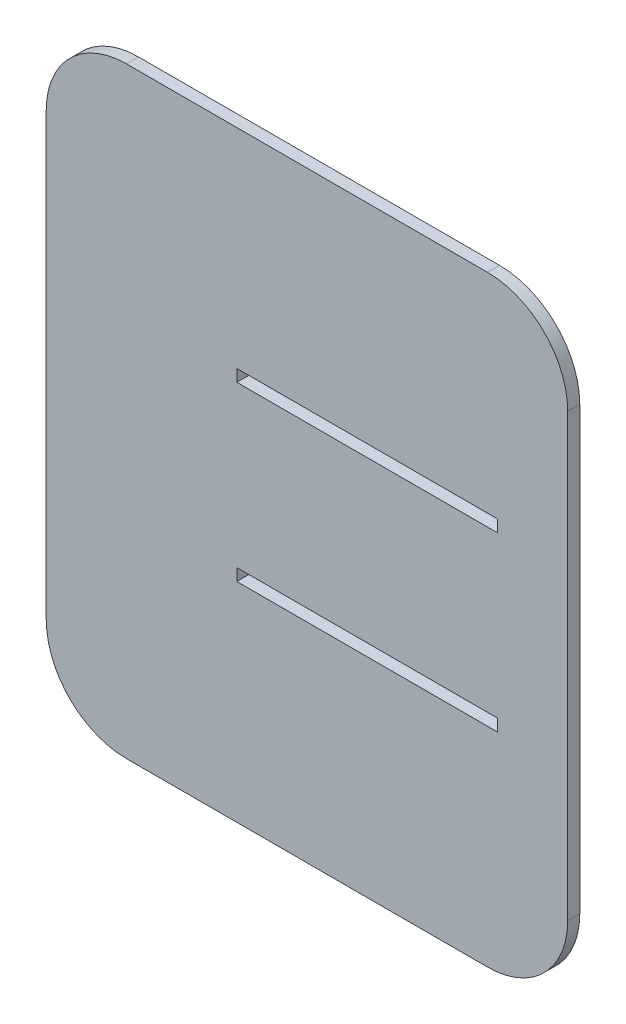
SolidWorks part; units mm, degrees
ref_plane "Plan de face" through (0, 0, 0) normal (0, 0, 1) x (1, 0, 0)
ref_plane "Plan de dessus" through (0, 0, 0) normal (0, 1, 0) x (1, 0, 0)
ref_plane "Plan de droite" through (0, 0, 0) normal (1, 0, 0) x (0, 0, -1)
sketch "Esquisse1" plane through (0, 0, 0) normal (0, 0, 1) x (1, 0, 0)
  line L0 (-13.7092, 13.9105) -> (115.8085, 13.9105) construction
  line L1 (-5.6409, 88.9105) -> (84.3591, 88.9105)
  line L3 (-5.6409, -61.0895) -> (84.3591, -61.0895)
  line L4 (104.3591, 68.9105) -> (104.3591, -41.0895)
  line L5 (86.8591, 33.9105) -> (86.8591, 36.9105)
  line L6 (21.8591, -6.0895) -> (86.8591, -6.0895)
  line L7 (21.8591, -6.0895) -> (21.8591, -9.0895)
  line L8 (21.8591, -9.0895) -> (86.8591, -9.0895)
  line L9 (86.8591, -6.0895) -> (86.8591, -9.0895)
  line L10 (21.8591, 33.9105) -> (21.8591, 36.9105)
  line L11 (21.8591, 36.9105) -> (86.8591, 36.9105)
  line L12 (21.8591, 33.9105) -> (86.8591, 33.9105)
  line L19 (-25.6409, 68.9105) -> (-25.6409, -41.0895)
  arc A4 (84.3591, -61.0895) -> (104.3591, -41.0895) centre (84.3591, -41.0895) ccw
  arc A5 (104.3591, 68.9105) -> (84.3591, 88.9105) centre (84.3591, 68.9105) ccw
  arc A6 (-5.6409, -61.0895) -> (-25.6409, -41.0895) centre (-5.6409, -41.0895) cw
  arc A7 (-25.6409, 68.9105) -> (-5.6409, 88.9105) centre (-5.6409, 68.9105) cw
  point P0 (0, 0)
  point P23 (104.3591, 13.9105)
  point P33 (104.3591, -61.0895)
  dimension "D6" = 20
  dimension "D9" = 20
  dimension "D2" = 150
  dimension "D3" = 65
  dimension "D4" = 3
  dimension "D5" = 17.5
  dimension "D8" = 20
  dimension "D11" = 130
extrude "Boss.-Extru.2" add sketch "Esquisse1" along normal blind 3
